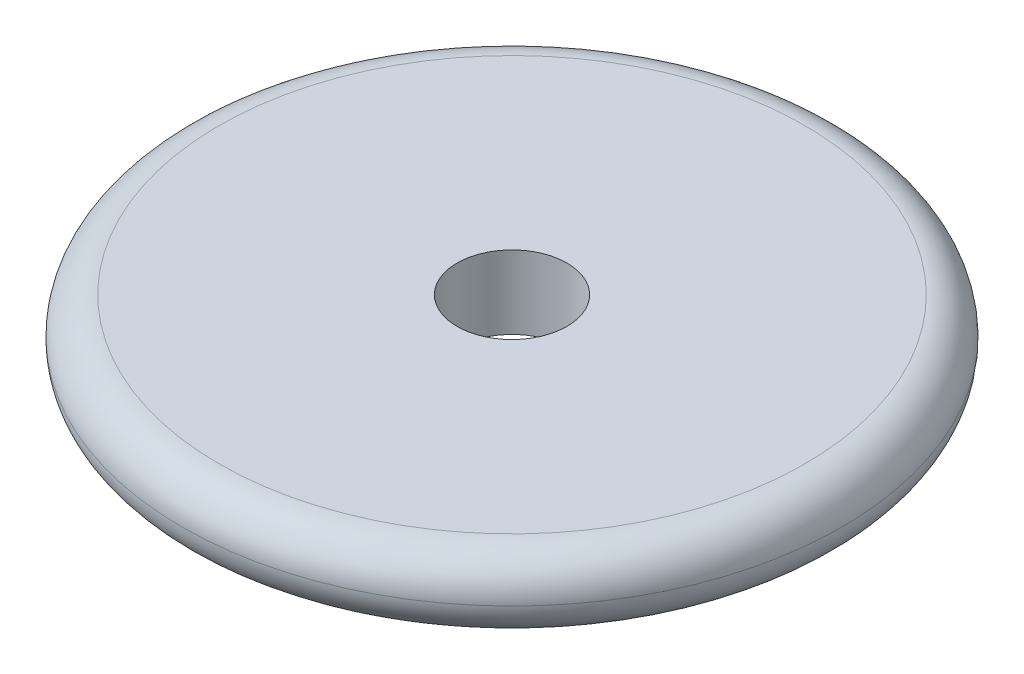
SolidWorks part; units mm, degrees
ref_plane "Front" through (0, 0, 0) normal (0, 0, 1) x (1, 0, 0)
ref_plane "Top" through (0, 0, 0) normal (0, 1, 0) x (1, 0, 0)
ref_plane "Right" through (0, 0, 0) normal (1, 0, 0) x (0, 0, -1)
sketch "Sketch2" plane through (0, 0, 0) normal (0, 1, 0) x (1, 0, 0)
  circle A0 centre (0, 0) radius 18
  dimension "D1" = 36
extrude "Extrude1" add sketch "Sketch2" along normal blind 4
fillet "Fillet1" radius 2 2 edges at (0, 0, 18) (0, 4, 18)
sketch "Sketch3" plane through (0, 0, 0) normal (0, -1, 0) x (1, 0, 0)
  circle A0 centre (0, 0) radius 3
  dimension "D1" = 6
extrude "Extrude2" cut sketch "Sketch3" against normal through all
